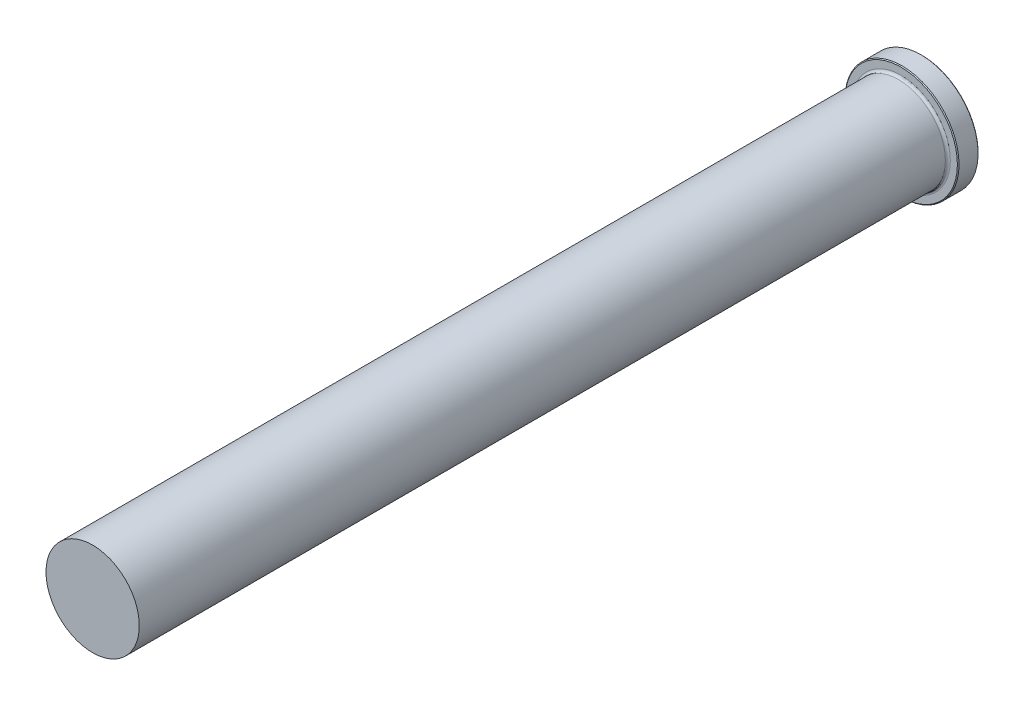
SolidWorks part; units mm, degrees
ref_plane "Front Plane" through (0, 0, 0) normal (0, 0, 1) x (1, 0, 0)
ref_plane "Top Plane" through (0, 0, 0) normal (0, 1, 0) x (1, 0, 0)
ref_plane "Right Plane" through (0, 0, 0) normal (1, 0, 0) x (0, 0, -1)
sketch "Sketch1" plane through (0, 0, 0) normal (1, 0, 0) x (0, 0, -1)
  line L0 (0, 0) -> (-156.8087, 0) construction
  line L1 (0, 0) -> (0, 17.4625)
  line L2 (0, 17.4625) -> (-6.35, 17.4625)
  line L3 (-6.35, 17.4625) -> (-6.35, 14.2875)
  line L4 (-6.35, 14.2875) -> (-254, 14.2875)
  line L5 (-254, 14.2875) -> (-254, 0)
  line L6 (-254, 0) -> (0, 0)
  dimension "D1" = 34.925
  dimension "D2" = 28.575
  dimension "D3" = 6.35
  dimension "D4" = 254
revolve "Revolve1" add sketch "Sketch1" angle 360 about L0
fillet "Fillet1" radius 0.762 1 edges at (-14.2875, 0, 6.35)
chamfer "Chamfer1" distance 0.254 angle 45 2 edges at (-17.4625, 0, 0) (-17.4625, 0, 6.35)
